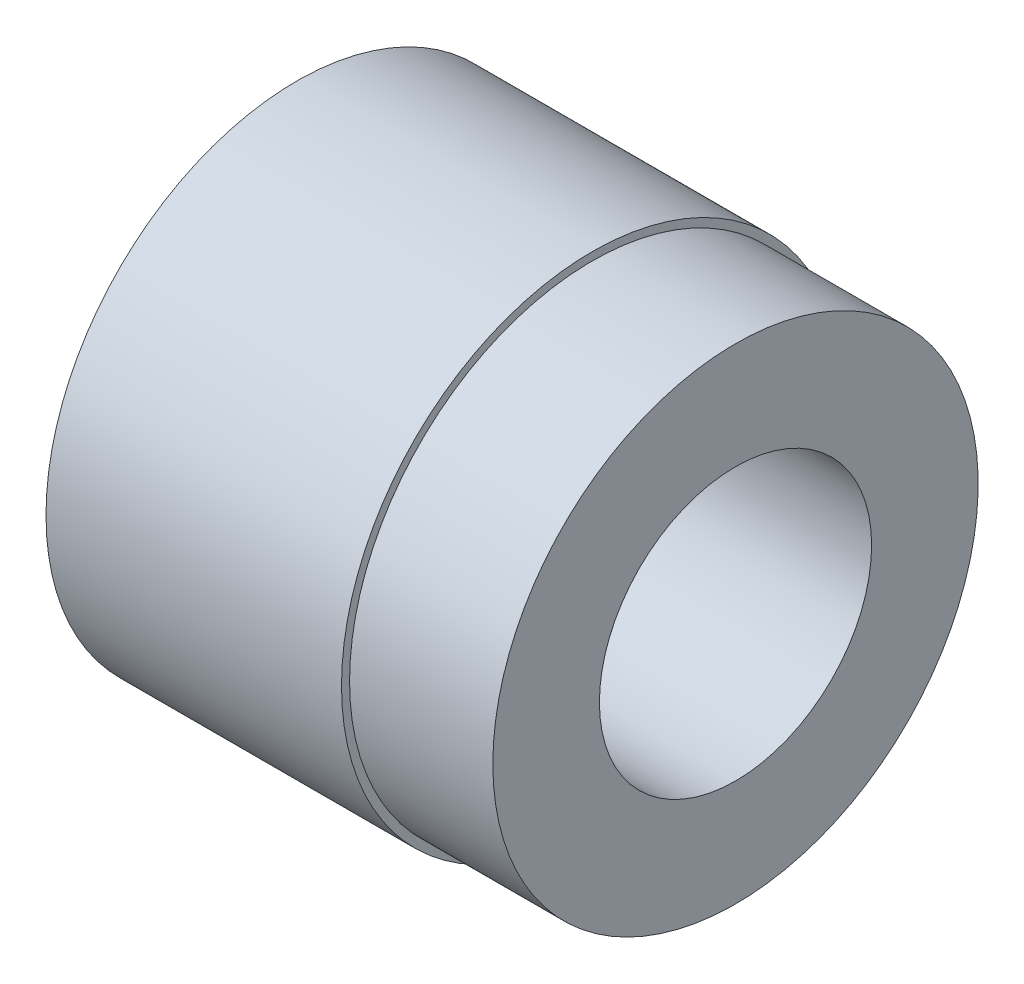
SolidWorks part; units mm, degrees
ref_plane "Plan de face" through (0, 0, 0) normal (0, 0, 1) x (1, 0, 0)
ref_plane "Plan de dessus" through (0, 0, 0) normal (0, 1, 0) x (1, 0, 0)
ref_plane "Plan de droite" through (0, 0, 0) normal (1, 0, 0) x (0, 0, -1)
sketch "Esquisse1" plane through (0, 0, 0) normal (0, 0, 1) x (1, 0, 0)
  line L0 (-87.3124, 0) -> (109.9251, 0) construction
  line L1 (43.604, 38) -> (43.604, 67.75)
  line L2 (43.604, 67.75) -> (3.604, 67.75)
  line L3 (3.604, 67.75) -> (3.604, 70)
  line L4 (3.604, 70) -> (-78.896, 70)
  line L5 (-78.896, 70) -> (-78.896, 38)
  line L6 (-78.896, 38) -> (43.604, 38)
  dimension "D1" = 70
  dimension "D2" = 67.75
  dimension "D3" = 40
  dimension "D4" = 122.5
  dimension "D5" = 38
revolve "Révolution1" add sketch "Esquisse1" angle 360 about L0
